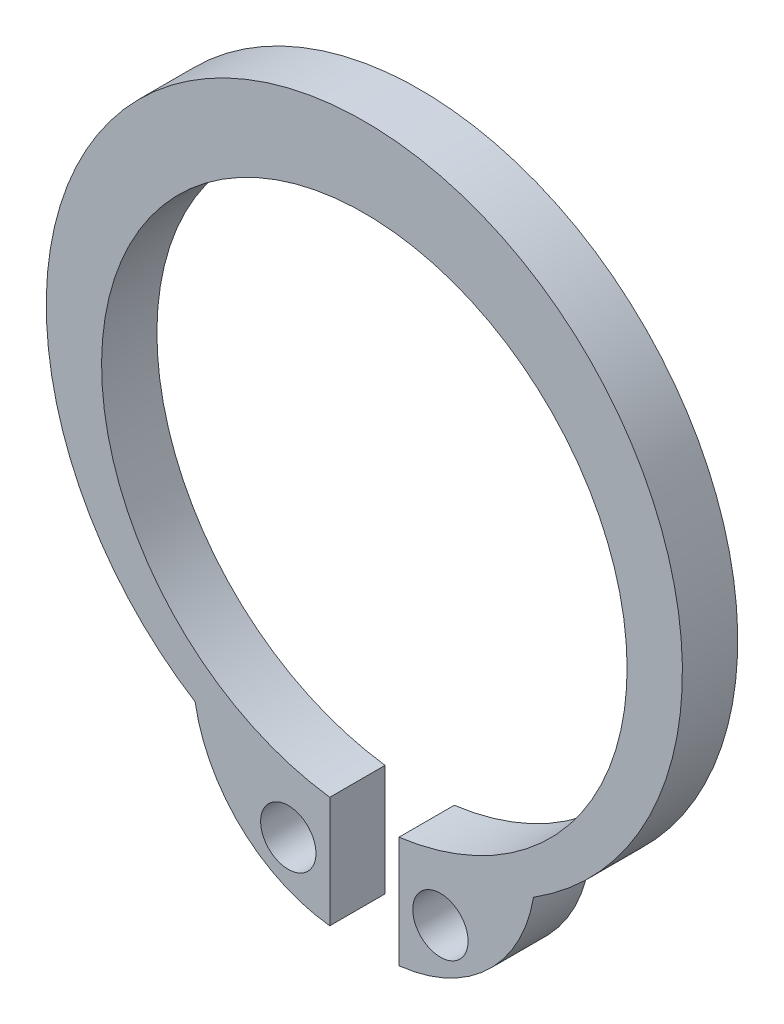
SolidWorks part; units mm, degrees
ref_plane "Plane1" through (0, 0, 0) normal (0, 0, 1) x (1, 0, 0)
ref_plane "Plane2" through (0, 0, 0) normal (0, 1, 0) x (1, 0, 0)
ref_plane "Plane3" through (0, 0, 0) normal (1, 0, 0) x (0, 0, -1)
sketch "Esquisse1" plane through (0, 0, 0) normal (0, 0, 1) x (1, 0, 0)
  line L0 (-0.5, -3.767) -> (-0.5, -5.3768)
  line L2 (0.5, -3.767) -> (0.5, -5.3768)
  arc A0 (0.5, -3.767) -> (-0.5, -3.767) centre (0, 0) ccw
  arc A2 (-0.5, -5.3768) -> (-2.4472, -3.545) centre (-0.2628, -3.1739) cw
  arc A3 (0.5, -5.3768) -> (2.4472, -3.545) centre (0.2628, -3.1739) ccw
  arc A4 (2.4472, -3.545) -> (-2.4472, -3.545) centre (0, 0.35) ccw
  dimension "D1" = 7.6
  dimension "D2" = 0.35
  dimension "D4" = 0.5
  dimension "D5" = 5.4
extrude "Base-Extrusion" add sketch "Esquisse1" along normal blind 0.8
sketch "Esquisse2" plane through (0, 0, 0.8) normal (0, 0, 1) x (1, 0, 0)
  line L0 (0, 6) -> (0, -6) construction
  circle A0 centre (-1.1, -4.5695) radius 0.4
  dimension "D1" = 0.8
  dimension "D2" = 1.1
  dimension "D3" = 4.7
extrude "Enlèv. mat.-Extru.1" cut sketch "Esquisse2" against normal through all
mirror "Symétrie1" about plane through (0, 0, 0) normal (1, 0, 0)
